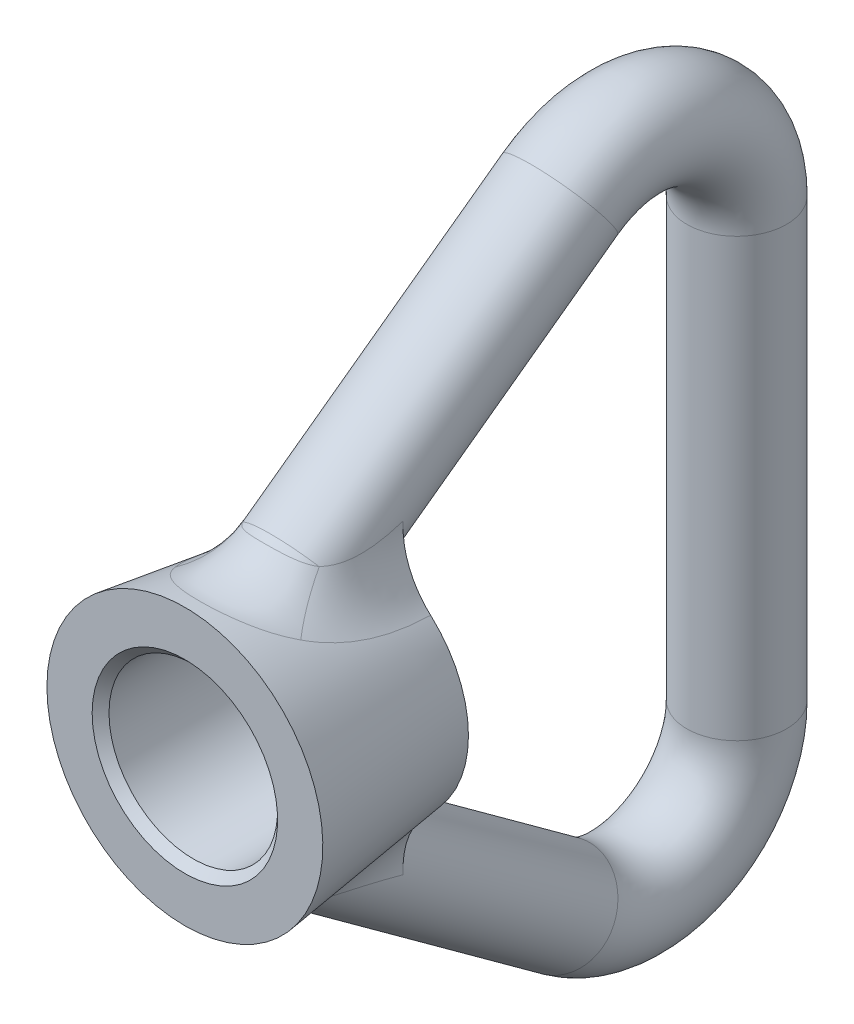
SolidWorks part; units mm, degrees
ref_plane "Front" through (0, 0, 0) normal (0, 0, 1) x (1, 0, 0)
ref_plane "Top" through (0, 0, 0) normal (0, 1, 0) x (1, 0, 0)
ref_plane "Right" through (0, 0, 0) normal (1, 0, 0) x (0, 0, -1)
sketch "Sketch1" plane through (0, 0, 0) normal (0, 1, 0) x (1, 0, 0)
  line L0 (0, 91.5074) -> (0, -17.3649) construction
  line L1 (0, 0) -> (18, 0)
  line L2 (18, 0) -> (15, 22)
  line L3 (15, 22) -> (0, 22)
  line L4 (0, 22) -> (0, 0)
  dimension "dk" = 36
  dimension "b" = 30
  dimension "m" = 22
revolve "BaseNut" add sketch "Sketch1" angle 360 about L0
sketch "Sketch2" plane through (0, 38.5, 38.5) normal (1, 0, 0) x (0, -1, 0)
  line L0 (38.5, 110.5) -> (38.5, 38.5) construction
  line L1 (23.5, 60.5) -> (20.5, 38.5) construction
  line L2 (38.5, 47.5) -> (34.7544, 47.5)
  line L3 (23.0321, 53.4654) -> (-1.7222, 87.4654)
  line L4 (10, 110.5) -> (67, 110.5)
  line L5 (53.9679, 53.4654) -> (78.7222, 87.4654)
  line L6 (38.5, 47.5) -> (42.2456, 47.5)
  line L10 (23.5, 60.5) -> (20.5, 38.5) construction
  line L11 (20.5, 38.5) -> (56.5, 38.5) construction
  line L14 (53.5, 60.5) -> (23.5, 60.5) construction
  arc A0 (-1.7222, 87.4654) -> (10, 110.5) centre (10, 96) cw
  arc A1 (34.7544, 47.5) -> (23.0321, 53.4654) centre (34.7544, 62) cw
  arc A2 (42.2456, 47.5) -> (53.9679, 53.4654) centre (42.2456, 62) ccw
  arc A3 (78.7222, 87.4654) -> (67, 110.5) centre (67, 96) ccw
  circle A4 centre (67, 96) radius 4 construction
  point P18 (38.5, 110.5)
  point P25 (22.6218, 54.0596)
  dimension "d2" = 14.5
  dimension "R" = 8
  dimension "l" = 86
  dimension "k" = 72
  dimension "D4" = 13
  dimension "D5" = 6.5
ref_plane "RefPlane" through (0, 3.7456, -9) normal (0, 1, 0) x (-1, 0, 0)
sketch "Sketch3" plane through (0, 3.7456, 3) normal (0, 1, 0) x (1, 0, 0)
  circle A0 centre (0, 12) radius 6.5
  dimension "d" = 13
sweep "WingTrim" add profiles "Sketch3" path "Sketch2"
fillet "Fillet1" radius 11 6 edges at (5.6007, -14.3501, -19.0347) (-5.9402, -14.3737, -17.946) (5.9402, 14.3737, -17.946) (-5.6007, 14.3501, -19.0347) (0.5782, -17.0021, -7.2462) (0.5782, 17.0021, -7.2462)
sketch "Sketch4" plane through (3.9634, -0.4384, -22) normal (0, 0, -1) x (-1, 0, 0)
  circle A0 centre (3.9634, 0.4384) radius 11
  arc A1 (14.0324, -10.6798) -> (14.0324, 11.5567) centre (3.9634, 0.4384) ccw construction
  dimension "xd" = 22
extrude "Hole" cut sketch "Sketch4" against normal through all
chamfer "Chamfer1" distance 1.1 angle 45 1 edges at (-11, 0, 0)
sketch "Sketch5" plane through (0, 0, 0) normal (1, 0, 0) x (0, 0, -1)
  line L0 (-17.3072, 0) -> (33.4909, 0) construction
  line L1 (0.6, -10) -> (1.6, -10)
  line L2 (1.6, -10) -> (1.6, -11)
  line L3 (1.6, -11) -> (1.1, -11.866)
  line L4 (1.1, -11.866) -> (0.6, -11)
  line L5 (0.6, -11) -> (0.6, -10)
  line L6 (1.1, -11) -> (1.1, 11) construction
  dimension "D1" = 1
  dimension "D2" = 22
revolve "Cut-Revolve10" [suppressed] cut sketch "Sketch5" angle 360 about L0
pattern_linear "LPattern10" [suppressed] count 17 spacing 1.2 along (0, 0, 1)
equation "\"D4@Sketch2\" = \"d@Sketch3\""
equation "\"D5@Sketch2\" = \"D4@Sketch2\" / 2"
equation "\"D1@Chamfer1\" = \"xd@Sketch4\" / 20"
equation "\"d2@Sketch2\" = \"R@Sketch2\" + \"d@Sketch3\" / 2"
equation "\"D2@Sketch5\" = \"xd@Sketch4\""
equation "\"D1@Sketch5\" = (  \"D2@ThreadCosmetic1\" - \"xd@Sketch4\" )  / 2"
equation "\"D3@LPattern10\" = \"D1@Sketch5\" * 1.2"
equation "\"D1@LPattern10\" = \"m@Sketch1\" / \"D3@LPattern10\"-1"
